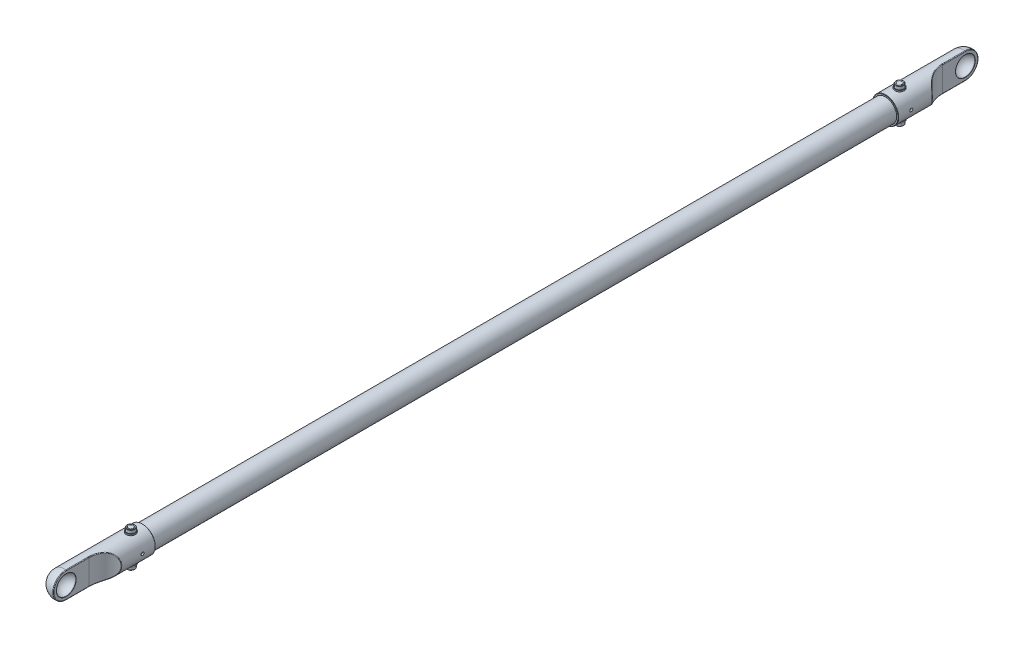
SolidWorks part; units mm, degrees
ref_plane "前视基准面" through (0, 0, 0) normal (0, 0, 1) x (1, 0, 0)
ref_plane "上视基准面" through (0, 0, 0) normal (0, 1, 0) x (1, 0, 0)
ref_plane "右视基准面" through (0, 0, 0) normal (1, 0, 0) x (0, 0, -1)
imported_body "1-SP0389-23112608-4-solid1"
imported_body "1-SP0389-23112604-11-solid1"
imported_body "1-SP0389-23112602-6-solid1"
imported_body "1-SP0389-23112605-11-solid1"
imported_body "1-SP0389-23112603-12-solid1"
imported_body "1-SP0389-23112603-13-solid1"
imported_body "1-SP0389-23112604-15-solid1"
imported_body "1-SP0389-23112605-14-solid1"
imported_body "1-SP0389-23112603-17-solid1"
imported_body "1-SP0389-23112603-18-solid1"
imported_body "1-SP0389-23112602-8-solid1"
sketch "草图1" plane through (0, 0, 1289) normal (0, 0, -1) x (-1, 0, 0)
  circle A0 centre (7.5, 0) radius 6 construction
  circle A1 centre (7.5, 0) radius 6
extrude "凸台-拉伸1" add sketch "草图1" along normal up to surface (45 mm away)
sketch "草图2" plane through (-14, 0, 0) normal (-1, 0, 0) x (0, 0, 1)
  circle A1 centre (1309, 0) radius 6.8
  circle A2 centre (1309, 0) radius 6.8
  dimension "D1" = 0
extrude "凸台-拉伸2" add sketch "草图2" along normal up to surface (3 mm away)
sketch "草图3" plane through (0, 0, -51) normal (0, 0, 1) x (1, 0, 0)
  circle A0 centre (-7.5, 0) radius 6 construction
  circle A1 centre (-7.5, 0) radius 6
extrude "凸台-拉伸3" add sketch "草图3" along normal up to surface (45 mm away)
sketch "草图4" plane through (-14, 0, 0) normal (-1, 0, 0) x (0, 0, 1)
  circle A1 centre (-71, 0) radius 6.8
  circle A2 centre (-71, 0) radius 6.8
  dimension "D1" = 0
extrude "凸台-拉伸4" add sketch "草图4" along normal up to surface (3 mm away)
